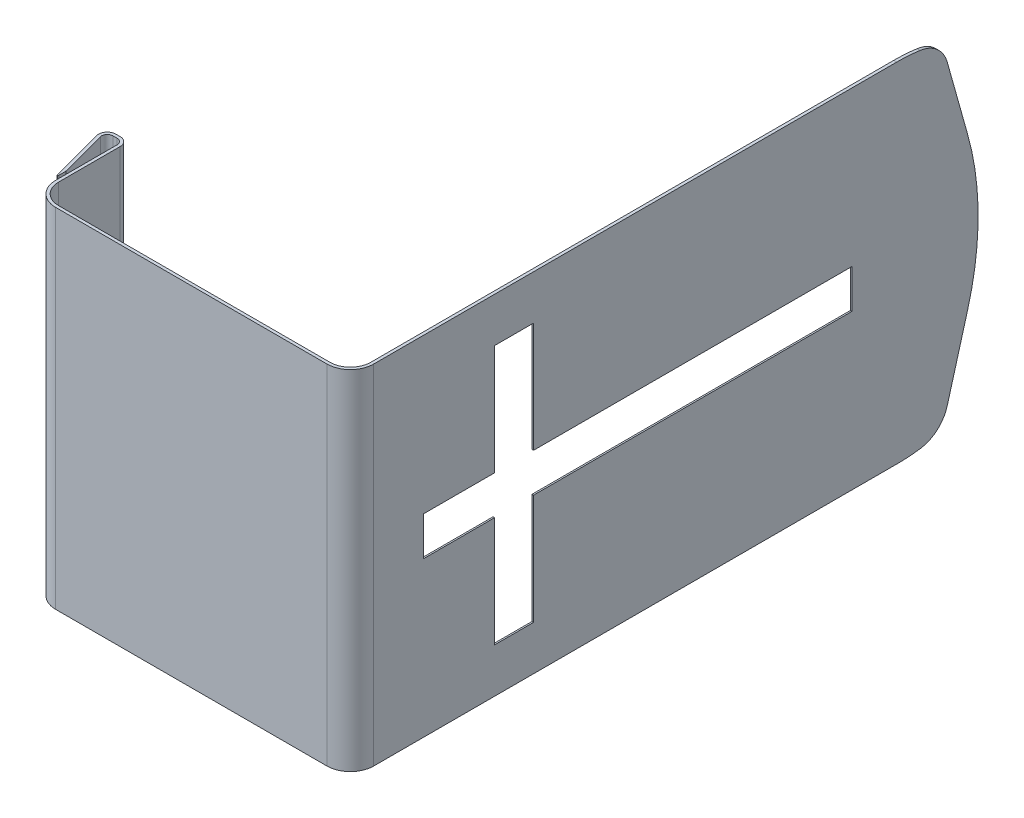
SolidWorks part; units mm, degrees
ref_plane "Front Plane" through (0, 0, 0) normal (1, 0, 0) x (0, 1, 0)
ref_plane "Top Plane" through (0, 0, 0) normal (0, 0, 1) x (0, 1, 0)
ref_plane "Right Plane" through (0, 0, 0) normal (0, 1, 0) x (-1, 0, 0)
sketch "sk cross 2" plane through (0, 0, 0) normal (1, 0, 0) x (0, 1, 0)
  line L12 (0, 229) -> (0, -229) construction
  point P2 (0, 0)
  line B0 (-20.75, 229) -> (20.75, 229)
  line B1 (20.75, 229) -> (20.75, 152.75)
  line B2 (20.75, 152.75) -> (138.525, 152.75)
  line B3 (138.525, 152.75) -> (138.525, 111.25)
  line B4 (138.525, 111.25) -> (20.75, 111.25)
  line B5 (20.75, 111.25) -> (20.75, -229)
  line B6 (20.75, -229) -> (-20.75, -229)
  line B7 (-20.75, -229) -> (-20.75, 111.25)
  line B8 (-20.75, 111.25) -> (-138.475, 111.25)
  line B9 (-138.475, 111.25) -> (-138.475, 152.75)
  line B10 (-138.475, 152.75) -> (-20.75, 152.75)
  line B11 (-20.75, 152.75) -> (-20.75, 229)
sketch_block_instance "Block1-1"
sketch_block "Block1"
sketch "Sketch1" plane through (0, 0, 0) normal (1, 0, 0) x (0, 1, 0)
  line L0 (-20.75, 229) -> (20.75, 229) construction
  line L1 (-186.0633, 277) -> (186.0633, 277)
  line L2 (-186.0633, 277) -> (-186.0633, -277)
  line L3 (-186.0633, -277) -> (186.0633, -277)
  line L4 (186.0633, 277) -> (186.0633, -277)
  line L5 (-186.0633, 277) -> (186.0633, -277) construction
  line L6 (-186.0633, -277) -> (186.0633, 277) construction
  line L8 (-138.475, 111.25) -> (-138.475, 152.75) construction
  point P0 (0, 0)
  dimension "D1" = 48
  dimension "D2" = 47.5883
extrude "Boss-Extrude1" add sketch "Sketch1" along normal blind 3.175
extrude "Cut-Extrude1" cut sketch "sk cross 2" along normal blind 3.175
chamfer "Chamfer1" distance 1.524 angle 45 12 edges at (0, 0, 229) (0, 20.75, 190.875) (0, 79.6375, 152.75) (0, 138.525, 132) (0, 79.6375, 111.25) (0, 20.75, -58.875) (0, 0, -229) (0, -20.75, -58.875) (0, -79.6125, 111.25) (0, -138.475, 132) (0, -79.6125, 152.75) (0, -20.75, 190.875)
sketch "Sketch2" plane through (0, 0, 0) normal (0, 1, 0) x (-1, 0, 0)
  line L0 (0, 277) -> (0, 282)
  line L1 (-3.175, 277) -> (-3.175, 282)
  line L2 (21.825, 307) -> (311.825, 307)
  line L7 (336.825, 282) -> (336.825, 216.175)
  line L8 (342.825, 210.175) -> (347.4577, 210.175)
  line L9 (353.2533, 217.7279) -> (339.8591, 267.7157)
  line L10 (21.825, 303.825) -> (311.825, 303.825)
  line L11 (333.65, 282) -> (333.65, 216.175)
  line L12 (342.825, 207) -> (347.4577, 207)
  line L13 (356.3201, 218.5497) -> (340.7909, 276.5052)
  line L14 (340.5662, 276.445) -> (340.7909, 276.5052)
  line L15 (-3.175, 277) -> (0, 277)
  line L16 (339.825, 275.4791) -> (339.825, 267.9745)
  line L17 (353.2533, 217.7279) -> (337.7241, 275.6835) construction
  arc A0 (-3.175, 282) -> (21.825, 307) centre (21.825, 282) cw
  arc A1 (311.825, 307) -> (336.825, 282) centre (311.825, 282) cw
  arc A2 (336.825, 216.175) -> (342.825, 210.175) centre (342.825, 216.175) ccw
  arc A3 (347.4577, 210.175) -> (353.2533, 217.7279) centre (347.4577, 216.175) ccw
  arc A4 (0, 282) -> (21.825, 303.825) centre (21.825, 282) cw
  arc A5 (311.825, 303.825) -> (333.65, 282) centre (311.825, 282) cw
  arc A6 (333.65, 216.175) -> (342.825, 207) centre (342.825, 216.175) ccw
  arc A7 (347.4577, 207) -> (356.3201, 218.5497) centre (347.4577, 216.175) ccw
  arc A8 (339.8591, 267.7157) -> (339.825, 267.9745) centre (340.825, 267.9745) cw
  arc A9 (339.825, 275.4791) -> (340.5662, 276.445) centre (340.825, 275.4791) cw
  point P36 (339.825, 276.2464)
  dimension "D1" = 25
  dimension "D4" = 6
  dimension "D11" = 1
  dimension "D2" = 5
  dimension "D3" = 15
  dimension "D6" = 340
  dimension "D7" = 60
  dimension "D8" = 3
  dimension "D9" = 100
  dimension "D10" = 1
  dimension "D5" = 3.175
extrude "Boss-Extrude2" add sketch "Sketch2" along normal mid plane 372.1265
sketch "Sketch3" plane through (0, 0, 0) normal (1, 0, 0) x (0, 1, 0)
  line L0 (-186.0633, 277) -> (-186.0633, -277) construction
  line L1 (0, -277) -> (-179.7233, -325.1567) construction
  line L2 (0, -277) -> (179.7233, -325.1567) construction
  line L3 (-186.0633, -277) -> (186.0633, -277) construction
  line L4 (-159.1499, -330.9233) -> (-80.9681, -352.8373)
  line L5 (80.9681, -352.8373) -> (159.1499, -330.9233)
  line L6 (-186.0633, -277) -> (186.0633, -277)
  line L8 (-284.7972, -351.0499) -> (303.8641, -351.0499) construction
  arc A0 (-186.0633, -277) -> (-184.3886, -301.9075) centre (0, -277) ccw
  arc A1 (184.3886, -301.9075) -> (186.0633, -277) centre (0, -277) ccw
  arc A2 (-80.9681, -352.8373) -> (80.9681, -352.8373) centre (0, -63.9703) ccw
  arc A3 (184.3886, -301.9075) -> (159.1499, -330.9233) centre (149.7036, -297.2222) cw
  arc A4 (-159.1499, -330.9233) -> (-184.3886, -301.9075) centre (-149.7036, -297.2222) cw
  point P18 (0, -375.5323)
  dimension "D3" = 300
  dimension "D4" = 35
  dimension "D1" = 15
  dimension "D2" = 15
extrude "Boss-Extrude3" add sketch "Sketch3" along normal up to surface (3.175 mm away)
ref_plane "Bottom of face" through (0, 0, -273) normal (0, 0, 1) x (0, 1, 0)
